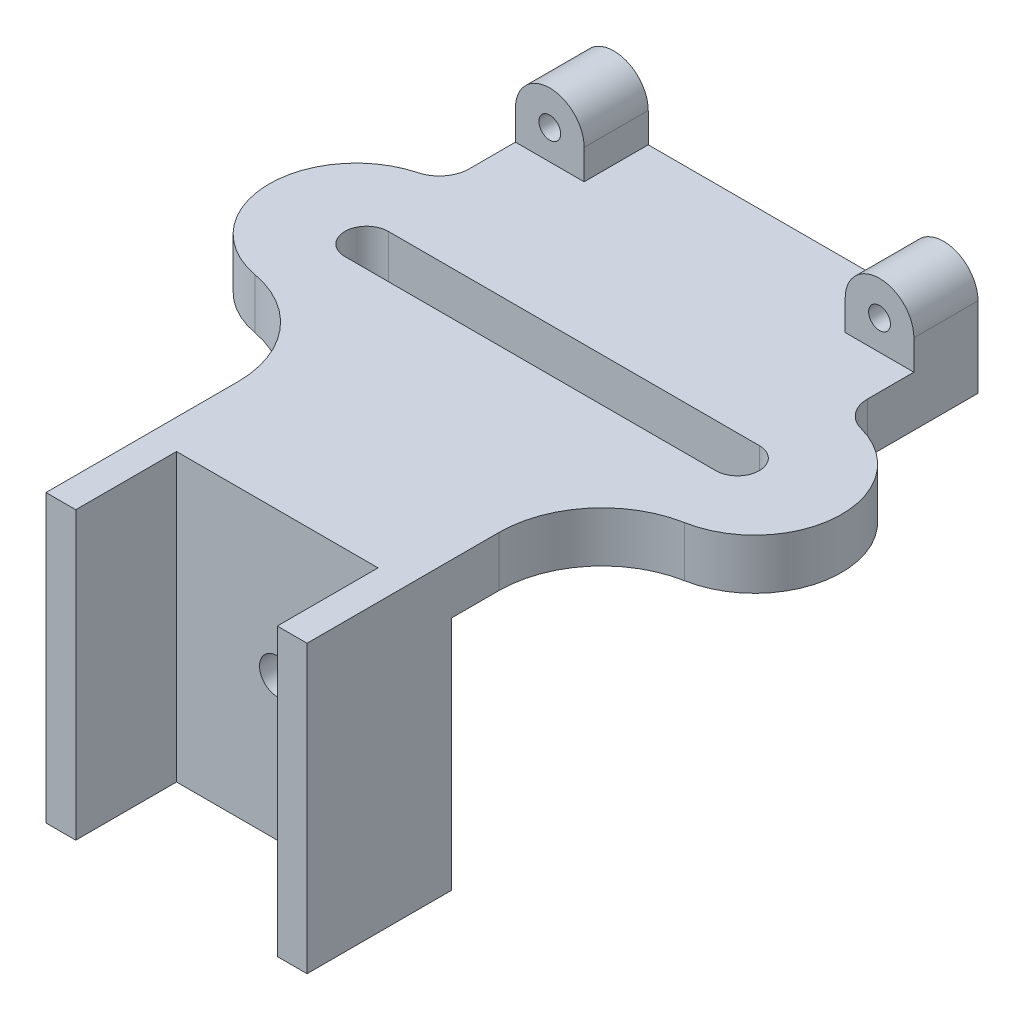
SolidWorks part; units mm, degrees
ref_plane "Front Plane" through (0, 0, 0) normal (0, 0, 1) x (1, 0, 0)
ref_plane "Top Plane" through (0, 0, 0) normal (0, 1, 0) x (1, 0, 0)
ref_plane "Right Plane" through (0, 0, 0) normal (1, 0, 0) x (0, 0, -1)
sketch "Sketch1" plane through (0, 0, 0) normal (0, 1, 0) x (1, 0, 0)
  line L0 (-44.196, 0) -> (44.196, 0)
  line L1 (44.196, 0) -> (44.196, -49.5584) construction
  line L2 (44.196, 0) -> (44.196, -24.5062)
  line L3 (0, 0) -> (0, -133.604) construction
  line L4 (22.352, -111.252) -> (22.352, -133.604)
  line L5 (0, -133.604) -> (0, -111.252) construction
  line L6 (-22.352, -111.252) -> (22.352, -111.252)
  line L7 (22.352, -133.604) -> (28.956, -133.604)
  line L8 (28.956, -133.604) -> (28.956, -91.0281)
  line L9 (0, -133.604) -> (0, -50.292) construction
  line L10 (0, -50.292) -> (41.148, -50.292) construction
  line L11 (0, -55.118) -> (41.148, -55.118)
  line L12 (0, -45.466) -> (41.148, -45.466)
  line L13 (0, -50.292) -> (-41.148, -50.292) construction
  line L14 (-44.196, 0) -> (-44.196, -49.5584) construction
  line L15 (0, -45.466) -> (-41.148, -45.466)
  line L16 (0, -55.118) -> (-41.148, -55.118)
  line L17 (-28.956, -133.604) -> (-28.956, -91.0281)
  line L18 (-22.352, -133.604) -> (-28.956, -133.604)
  line L19 (-22.352, -111.252) -> (-22.352, -133.604)
  line L20 (-44.196, 0) -> (-44.196, -24.5062)
  arc A0 (49.1166, -30.8921) -> (47.6847, -68.5445) centre (44.196, -49.5584) cw
  arc A1 (49.1166, -30.8921) -> (44.196, -24.5062) centre (50.8, -24.5062) cw
  arc A2 (47.6847, -68.5445) -> (28.956, -91.0281) centre (51.816, -91.0281) ccw
  arc A3 (41.148, -45.466) -> (41.148, -55.118) centre (41.148, -50.292) cw
  arc A4 (-41.148, -45.466) -> (-41.148, -55.118) centre (-41.148, -50.292) ccw
  arc A5 (-47.6847, -68.5445) -> (-28.956, -91.0281) centre (-51.816, -91.0281) cw
  arc A6 (-49.1166, -30.8921) -> (-44.196, -24.5062) centre (-50.8, -24.5062) ccw
  arc A7 (-49.1166, -30.8921) -> (-47.6847, -68.5445) centre (-44.196, -49.5584) ccw
  point P8 (44.196, -30.2544)
  point P23 (63.4861, -50.292)
  point P24 (0, -41.4654)
  point P38 (-44.196, -30.2544)
  point P39 (0, 0)
  point P40 (0, -45.466)
  point P41 (0, 0)
  dimension "D1" = 19.304
  dimension "D2" = 6.604
  dimension "D8" = 22.86
  dimension "D3" = 44.196
  dimension "D4" = 133.604
  dimension "D5" = 22.352
  dimension "D6" = 22.352
  dimension "D7" = 6.604
  dimension "D9" = 60.96
  dimension "D10" = 41.148
  dimension "D12" = 9.652
  dimension "D13" = 133.604
  dimension "D11" = 4.826
extrude "Boss-Extrude1" add sketch "Sketch1" along normal blind 11.176
sketch "Sketch3" plane through (0, 0, 0) normal (0, 0, -1) x (-1, 0, 0)
  line L0 (-44.196, 17.78) -> (-44.196, 11.176)
  line L1 (-44.196, 11.176) -> (44.196, 11.176) construction
  line L2 (-36.576, 11.176) -> (-36.576, 17.78) construction
  line L3 (-44.196, 11.176) -> (-28.956, 11.176)
  line L4 (-28.956, 11.176) -> (-28.956, 17.78)
  line L5 (0, 0) -> (0, 23.9185) construction
  line L6 (-44.196, 11.176) -> (-44.196, 17.78)
  line L7 (-28.956, 17.78) -> (-28.956, 11.176)
  line L8 (-44.196, 17.78) -> (-44.196, 11.176)
  line L9 (-28.956, 11.176) -> (-28.956, 17.78)
  line L10 (-44.196, 11.176) -> (-44.196, 17.78)
  line L11 (-28.956, 17.78) -> (-28.956, 11.176)
  line L12 (44.196, 17.78) -> (44.196, 11.176)
  line L13 (44.196, 11.176) -> (28.956, 11.176)
  line L14 (28.956, 11.176) -> (28.956, 17.78)
  circle A0 centre (-36.576, 17.78) radius 2.413
  arc A1 (-44.196, 17.78) -> (-28.956, 17.78) centre (-36.576, 17.78) cw
  circle A2 centre (36.576, 17.78) radius 2.413
  arc A3 (44.196, 17.78) -> (28.956, 17.78) centre (36.576, 17.78) ccw
  point P2 (-28.956, 13.115)
  dimension "D3" = 4.826
  dimension "D4" = 7.62
  dimension "D1" = 36.576
  dimension "D2" = 6.604
extrude "Boss-Extrude2" add sketch "Sketch3" against normal blind 14.224 contours L4 A1 L0 L3 | A0 | L12 L13 L14 A3 | A2
sketch "Sketch4" plane through (0, 0, 0) normal (0, -1, 0) x (1, 0, 0)
  line L0 (22.352, 133.604) -> (28.956, 133.604) construction
  line L1 (22.352, 111.252) -> (22.352, 133.604) construction
  line L2 (-22.352, 133.604) -> (-22.352, 111.252) construction
  line L3 (-22.352, 111.252) -> (22.352, 111.252) construction
  line L4 (-28.956, 133.604) -> (-22.352, 133.604) construction
  line L5 (22.352, 133.604) -> (28.956, 133.604)
  line L6 (22.352, 111.252) -> (22.352, 133.604)
  line L7 (-22.352, 133.604) -> (-22.352, 111.252)
  line L8 (-22.352, 111.252) -> (22.352, 111.252)
  line L9 (-28.956, 133.604) -> (-22.352, 133.604)
  line L10 (-28.956, 133.604) -> (-28.956, 101.6)
  line L11 (-28.956, 101.6) -> (28.956, 101.6)
  line L12 (28.956, 133.604) -> (28.956, 91.0281) construction
  line L13 (28.956, 101.6) -> (28.956, 133.604)
  dimension "D1" = 32.004
extrude "Boss-Extrude3" add sketch "Sketch4" along normal blind 52.324
sketch "Sketch5" plane through (0, 0, 111.252) normal (0, 0, 1) x (1, 0, 0)
  line L0 (-22.352, 11.176) -> (22.352, 11.176) construction
  line L2 (-22.352, 11.176) -> (-22.352, -52.324) construction
  circle A0 centre (0, -20.828) radius 3.937
  point P4 (0, 11.176)
  dimension "D2" = 7.874
  dimension "D3" = 22.352
  dimension "D1" = 32.004
extrude "Cut-Extrude1" cut sketch "Sketch5" against normal blind 63.5
